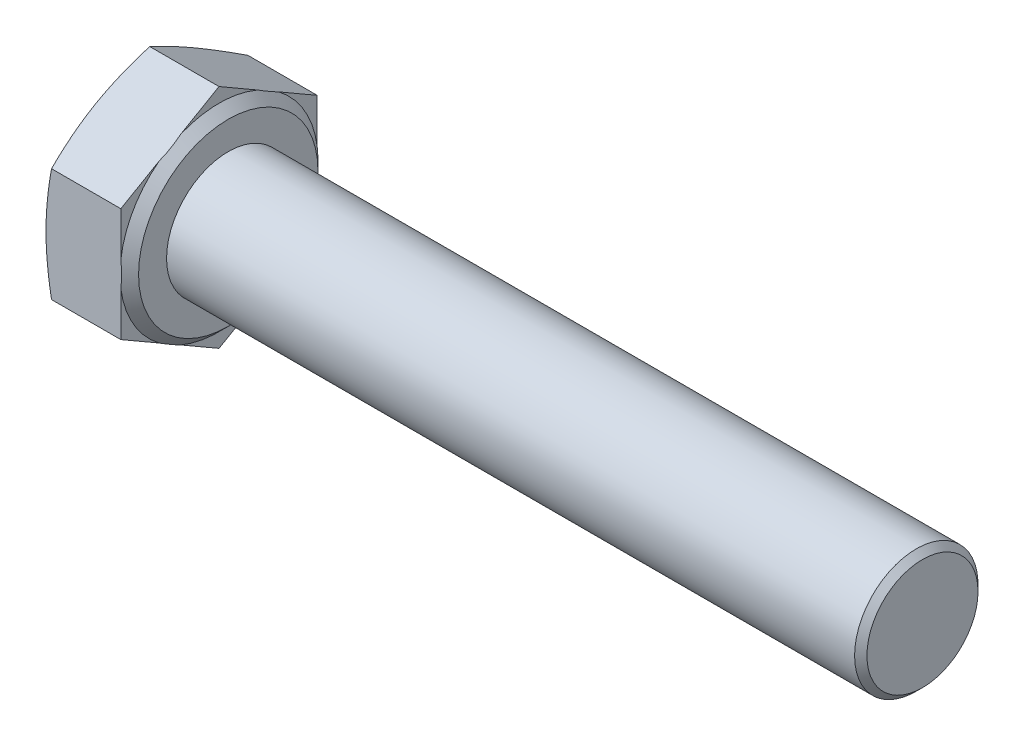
SolidWorks part; units mm, degrees
ref_plane "Front" through (0, 0, 0) normal (0, 0, 1) x (1, 0, 0)
ref_plane "Top" through (0, 0, 0) normal (0, 1, 0) x (1, 0, 0)
ref_plane "Right" through (0, 0, 0) normal (1, 0, 0) x (0, 0, -1)
sketch "Sketch2" plane through (0, 0, 0) normal (1, 0, 0) x (0, 0, -1)
  line L1 (6.365, -3.6748) -> (6.365, 3.6748)
  line L2 (6.365, 3.6748) -> (0, 7.3497)
  line L3 (0, 7.3497) -> (-6.365, 3.6748)
  line L4 (-6.365, 3.6748) -> (-6.365, -3.6748)
  line L5 (-6.365, -3.6748) -> (0, -7.3497)
  line L6 (0, -7.3497) -> (6.365, -3.6748)
  circle A0 centre (0, 0) radius 6.365 construction
  dimension "s" = 12.73
extrude "BaseHead" add sketch "Sketch2" along normal blind 5.45
sketch "Sketch3" plane through (0, 0, 0) normal (0, 0, 1) x (1, 0, 0)
  line L0 (5.45, 7.3497) -> (5.45, 5.815)
  line L2 (5.45, 5.815) -> (4.85, 6.415)
  line L3 (4.85, 6.415) -> (4.85, 7.3497)
  line L5 (4.85, 7.3497) -> (5.45, 7.3497)
  line L6 (-0.9571, 0) -> (7.6478, 0) construction
  line L7 (5.45, 7.3497) -> (0, 7.3497) construction
  dimension "D1" = 45
  dimension "c" = 0.6
  dimension "Dw" = 5.815
revolve "BearingFace" cut sketch "Sketch3" angle 360 about L6
sketch "Sketch4" plane through (0, 0, 0) normal (0, 0, 1) x (1, 0, 0)
  line L0 (-0.4935, 0) -> (3.5626, 0) construction
  line L2 (0, 7.3497) -> (0.3584, 7.3497)
  line L4 (0.3584, 7.3497) -> (0, 6.365)
  line L6 (0, 6.365) -> (0, 7.3497)
  line L7 (4.85, 7.3497) -> (0, 7.3497) construction
  dimension "D1" = 20
  dimension "D2" = 12.73
revolve "HeadChamfer" cut sketch "Sketch4" angle 360 about L0
sketch "Sketch5" plane through (5.45, 0, 0) normal (1, 0, 0) x (0, 0, -1)
  circle A0 centre (0, 0) radius 4
  dimension "d" = 8
extrude "BaseBody" add sketch "Sketch5" along normal blind 45
chamfer "Chamfer1" distance 0.4 angle 45 1 edges at (50.45, 0, -4)
fillet "HeadFillet" [suppressed] radius 0.4
sketch "Sketch6" plane through (0, 0, 0) normal (0, 0, 1) x (1, 0, 0)
  line L0 (5.45, 4.6765) -> (6.1265, 4.6765)
  line L1 (6.1265, 4.6765) -> (6.1265, 4)
  line L2 (6.1265, 4) -> (5.7882, 3.4141)
  line L3 (5.7882, 3.4141) -> (5.45, 4)
  line L4 (5.45, 4) -> (5.45, 4.6765)
  line L5 (50.05, 4) -> (5.45, 4) construction
  line L6 (5.45, -5.815) -> (5.45, 5.815) construction
  dimension "D1" = 0.6765
revolve "Cut-Revolve10" [suppressed] cut sketch "Sketch6" angle 360 about axis through (-0.9571, 0, 0) along (1, 0, 0)
pattern_linear "LPattern10" [suppressed] count 55
equation "\"D2@Sketch4\" = \"s@Sketch2\""
equation "\"D1@Chamfer1\" = 0.05 * \"d@Sketch5\""
equation "\"D1@Sketch6\" =  ( \"d@Sketch5\" - \"D2@ThreadCosmetic1\" )  / 2"
equation "\"pitch@LPattern10\" = \"D1@Sketch6\" * 1.2"
equation "\"D1@LPattern10\" = \"l@BaseBody\" / \"pitch@LPattern10\""
